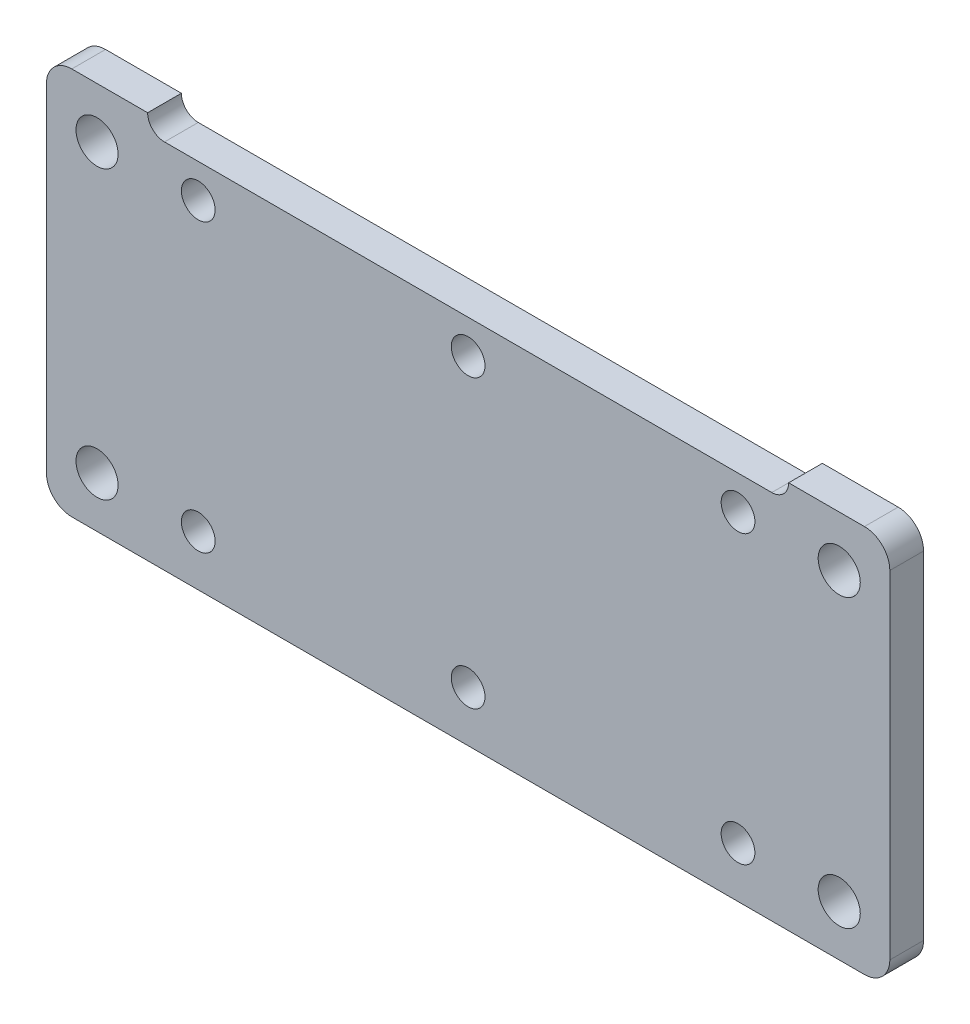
SolidWorks part; units mm, degrees
ref_plane "Front Plane" through (0, 0, 0) normal (0, 0, 1) x (1, 0, 0)
ref_plane "Top Plane" through (0, 0, 0) normal (0, 1, 0) x (1, 0, 0)
ref_plane "Right Plane" through (0, 0, 0) normal (1, 0, 0) x (0, 0, -1)
sketch "Sketch1" plane through (0, 0, 0) normal (0, 0, 1) x (1, 0, 0)
  line L0 (0, 0) -> (35.5941, 0) construction
  line L1 (0, 0) -> (0, 17.1222) construction
  line L2 (-79.375, -36.5125) -> (79.375, -36.5125)
  line L3 (79.375, -36.5125) -> (79.375, 36.5125)
  line L4 (79.375, 36.5125) -> (60.325, 36.5125)
  line L5 (-79.375, 36.5125) -> (-79.375, -36.5125)
  line L6 (-60.325, 36.5125) -> (-60.325, 33.3375)
  line L7 (-60.325, 33.3375) -> (60.325, 33.3375)
  line L8 (60.325, 33.3375) -> (60.325, 36.5125)
  line L9 (-60.325, 36.5125) -> (-79.375, 36.5125)
  circle A0 centre (-69.85, 26.9875) radius 3.9624
  circle A1 centre (-69.85, -26.9875) radius 3.9624
  circle A2 centre (69.85, -26.9875) radius 3.9624
  circle A3 centre (69.85, 26.9875) radius 3.9624
  circle A4 centre (-50.8, 26.9875) radius 3.175
  circle A5 centre (0, 26.9875) radius 3.175
  circle A6 centre (50.8, 26.9875) radius 3.175
  circle A7 centre (-50.8, -26.9875) radius 3.175
  circle A8 centre (0, -26.9875) radius 3.175
  circle A9 centre (50.8, -26.9875) radius 3.175
  dimension "D5" = 7.9248
  dimension "D6" = 6.35
  dimension "D1" = 158.75
  dimension "D2" = 73.025
  dimension "D3" = 139.7
  dimension "D4" = 53.975
  dimension "D7" = 53.975
  dimension "D8" = 101.6
  dimension "D9" = 3.175
  dimension "D10" = 9.525
extrude "Boss-Extrude1" add sketch "Sketch1" along normal blind 6.35
fillet "Fillet1" radius 4.7752 4 edges at (79.375, 36.5125, 3.175) (79.375, -36.5125, 3.175) (-79.375, -36.5125, 3.175) (-79.375, 36.5125, 3.175)
fillet "Fillet2" radius 3.175 2 edges at (-60.325, 33.3375, 3.175) (60.325, 33.3375, 3.175)
